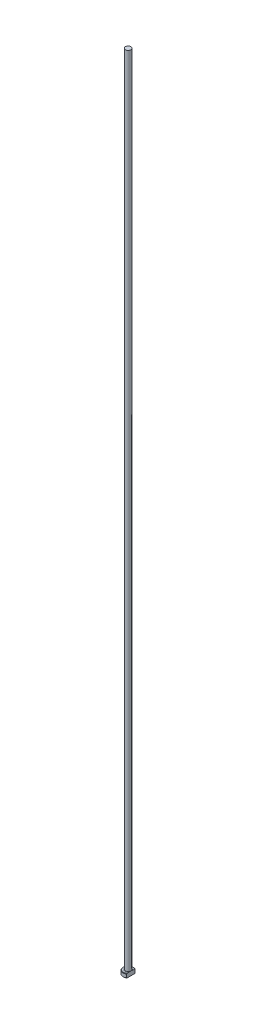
SolidWorks part; units mm, degrees
ref_plane "Front Plane" through (0, 0, 0) normal (0, 0, 1) x (1, 0, 0)
ref_plane "Top Plane" through (0, 0, 0) normal (0, 1, 0) x (1, 0, 0)
ref_plane "Right Plane" through (0, 0, 0) normal (1, 0, 0) x (0, 0, -1)
sketch "Sketch1" plane through (0, 0, 0) normal (0, 0, 1) x (1, 0, 0)
  line L0 (0, 259.9588) -> (0, -15.1925) construction
  line L1 (0, 0) -> (-2.5, 0)
  line L2 (-2.5, 0) -> (-2.5, 2)
  line L3 (-2.5, 2) -> (-1.35, 2)
  line L4 (-1.35, 2) -> (-1.35, 400)
  line L5 (-1.35, 400) -> (0, 400)
  line L6 (0, 400) -> (0, 0)
  dimension "L" = 400
  dimension "H" = 5
  dimension "T" = 2
  dimension "D" = 2.7
revolve "Revolve1" add sketch "Sketch1" angle 360 about L0
chamfer "Chamfer1" distance 0.2 angle 45 2 edges at (0, 2, 2.5) (0, 0, 2.5)
fillet "Fillet1" radius 0.2 1 edges at (0, 2, 1.35)
sketch "Sketch2" plane through (0, 0, 0) normal (0, 1, 0) x (1, 0, 0)
  line L0 (1.35, 2.1042) -> (1.35, -2.1042)
  circle A0 centre (0, 0) radius 2.5 construction
  arc A1 (1.35, -2.1042) -> (1.35, 2.1042) centre (0, 0) ccw
  circle A2 centre (0, 0) radius 1.35 construction
extrude "KEY" cut sketch "Sketch2" along normal through all
